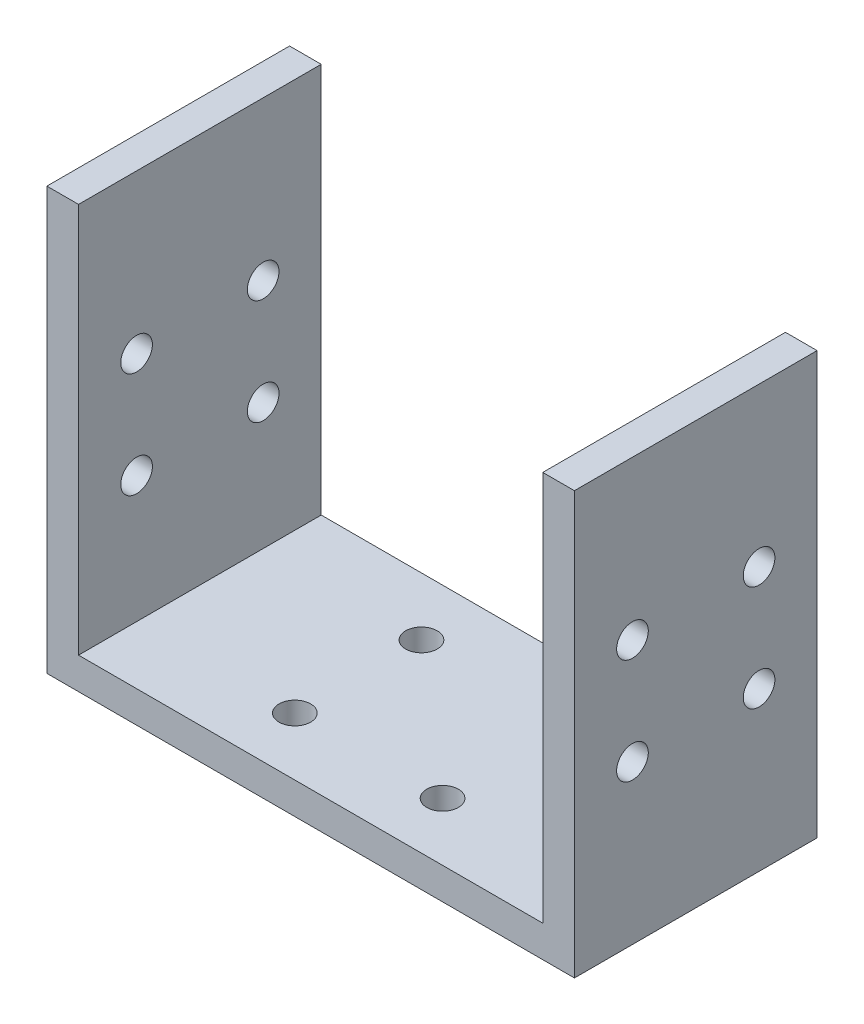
SolidWorks part; units mm, degrees
ref_plane "Front Plane" through (0, 0, 0) normal (0, 0, 1) x (1, 0, 0)
ref_plane "Top Plane" through (0, 0, 0) normal (0, 1, 0) x (1, 0, 0)
ref_plane "Right Plane" through (0, 0, 0) normal (1, 0, 0) x (0, 0, -1)
sketch "Sketch1" plane through (0, 0, 0) normal (0, 1, 0) x (1, 0, 0)
  line L1 (-25, -11.5) -> (25, -11.5)
  line L2 (-25, -11.5) -> (-25, 11.5)
  line L3 (-25, 11.5) -> (25, 11.5)
  line L4 (25, -11.5) -> (25, 11.5)
  line L5 (-25, -11.5) -> (25, 11.5) construction
  line L6 (-25, 11.5) -> (25, -11.5) construction
  point P0 (0, 0)
  dimension "D1" = 50
  dimension "D2" = 23
extrude "Boss-Extrude1" add sketch "Sketch1" along normal blind 40
shell "Shell1" thickness 3
sketch "Sketch2" plane through (0, 0, 0) normal (0, -1, 0) x (1, 0, 0)
  line L0 (0, 11.5) -> (0, -11.5) construction
  line L1 (-25, 11.5) -> (25, 11.5) construction
  line L2 (25, -11.5) -> (-25, -11.5) construction
  line L4 (-25, 6) -> (25, 6) construction
  line L5 (-25, -11.5) -> (-25, 11.5) construction
  line L6 (25, 11.5) -> (25, -11.5) construction
  line L7 (-25, -6) -> (25, -6) construction
  circle A0 centre (7, 6) radius 1.5
  circle A1 centre (7, -6) radius 1.5
  circle A2 centre (-7, -6) radius 1.5
  circle A3 centre (-7, 6) radius 1.5
  dimension "D7" = 3
  dimension "D8" = 3
  dimension "D9" = 3
  dimension "D10" = 3
  dimension "D1" = 7
  dimension "D2" = 7
  dimension "D3" = 6
  dimension "D4" = 12
  dimension "D5" = 7
  dimension "D6" = 7
extrude "Cut-Extrude1" cut sketch "Sketch2" against normal up to next
sketch "Sketch3" plane through (25, 0, 0) normal (1, 0, 0) x (0, 0, -1)
  line L0 (-11.5, 15) -> (11.5, 15) construction
  line L1 (-11.5, 40) -> (-11.5, 0) construction
  line L2 (11.5, 40) -> (11.5, 0) construction
  line L3 (0, 0) -> (0, 40) construction
  line L4 (-11.5, 0) -> (11.5, 0) construction
  line L5 (-11.5, 40) -> (11.5, 40) construction
  line L6 (-11.5, 25) -> (11.5, 25) construction
  circle A0 centre (-6, 15) radius 1.5
  circle A1 centre (6, 15) radius 1.5
  circle A2 centre (6, 25) radius 1.5
  circle A3 centre (-6, 25) radius 1.5
  dimension "D7" = 3
  dimension "D8" = 3
  dimension "D9" = 3
  dimension "D10" = 3
  dimension "D1" = 15
  dimension "D2" = 10
  dimension "D3" = 6
  dimension "D4" = 6
  dimension "D5" = 6
  dimension "D6" = 6
extrude "Cut-Extrude2" cut sketch "Sketch3" against normal through all and the other way through all
